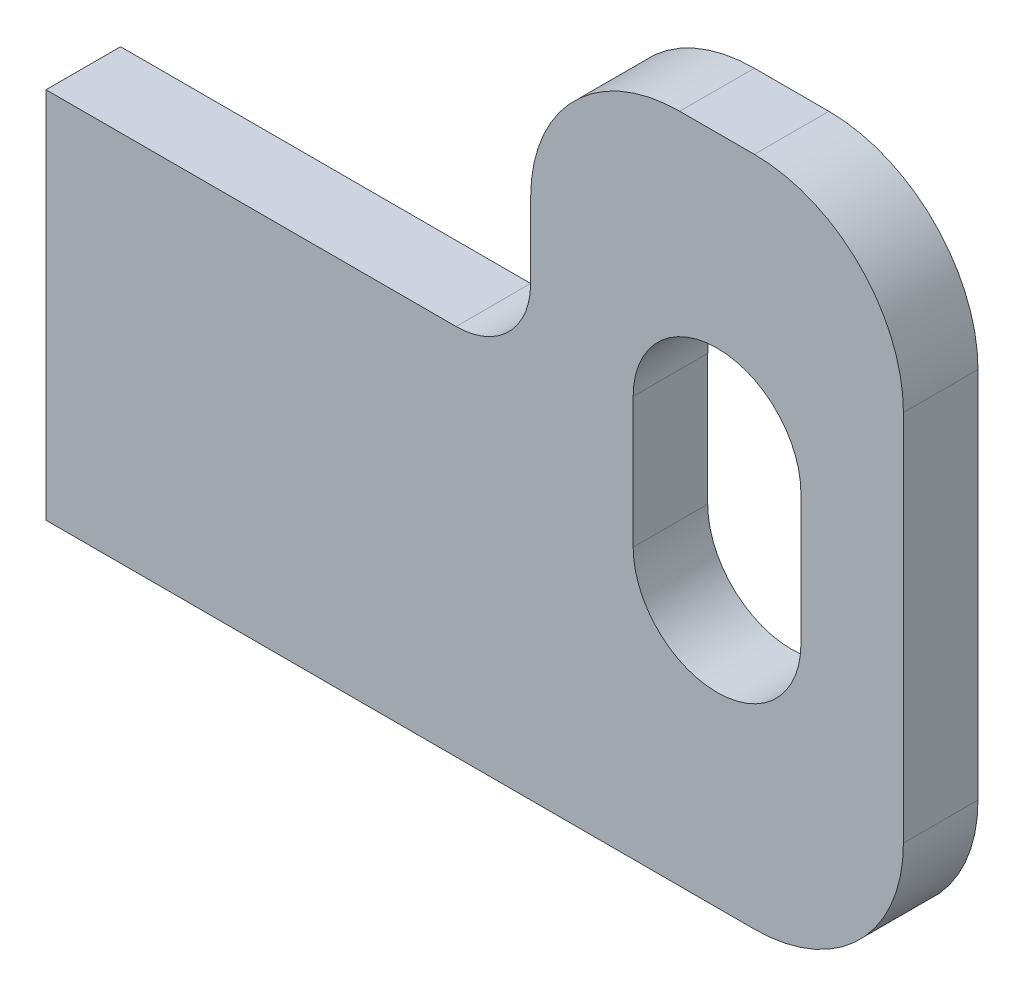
SolidWorks part; units mm, degrees
ref_plane "Front Plane" through (0, 0, 0) normal (0, 0, 1) x (1, 0, 0)
ref_plane "Top Plane" through (0, 0, 0) normal (0, 1, 0) x (1, 0, 0)
ref_plane "Right Plane" through (0, 0, 0) normal (1, 0, 0) x (0, 0, -1)
sketch "Sketch1" plane through (0, 0, 0) normal (0, 0, 1) x (1, 0, 0)
  line L0 (294.1111, 147.9932) -> (294.1111, 159.1057)
  line L1 (279.8236, 159.1057) -> (279.8236, 147.9932)
  line L2 (264.7418, 156.7254) -> (229.8168, 156.7254)
  line L3 (229.8168, 156.7254) -> (229.8168, 124.9754)
  line L4 (229.8168, 124.9754) -> (290.1418, 124.9754)
  line L5 (302.8418, 137.6754) -> (302.8418, 169.4254)
  line L6 (290.1418, 182.1254) -> (283.7918, 182.1254)
  line L7 (271.0918, 169.4254) -> (271.0918, 163.0754)
  arc A0 (279.8236, 147.9932) -> (294.1111, 147.9932) centre (286.9673, 147.9932) ccw
  arc A1 (294.1111, 159.1057) -> (279.8236, 159.1057) centre (286.9673, 159.1057) ccw
  arc A2 (290.1418, 124.9754) -> (302.8418, 137.6754) centre (290.1418, 137.6754) ccw
  arc A3 (302.8418, 169.4254) -> (290.1418, 182.1254) centre (290.1418, 169.4254) ccw
  arc A4 (283.7918, 182.1254) -> (271.0918, 169.4254) centre (283.7918, 169.4254) ccw
  arc A5 (264.7418, 156.7254) -> (271.0918, 163.0754) centre (264.7418, 163.0754) ccw
extrude "Extrude1" add sketch "Sketch1" along normal blind 6.35
